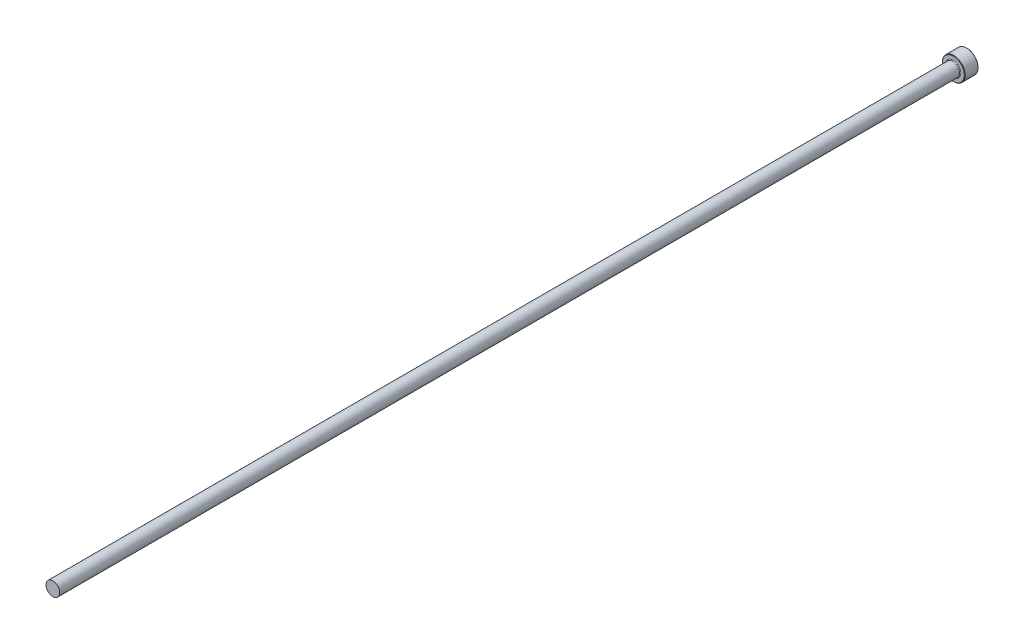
SolidWorks part; units mm, degrees
ref_plane "Front Plane" through (0, 0, 0) normal (0, 0, 1) x (1, 0, 0)
ref_plane "Top Plane" through (0, 0, 0) normal (0, 1, 0) x (1, 0, 0)
ref_plane "Right Plane" through (0, 0, 0) normal (1, 0, 0) x (0, 0, -1)
sketch "Sketch1" plane through (0, 0, 0) normal (1, 0, 0) x (0, 0, -1)
  line L0 (0, 0) -> (0, 5)
  line L1 (0, 5.5) -> (0, -5.5) construction
  line L2 (0, 5) -> (-6, 5)
  line L3 (-6, 5) -> (-6, 3.3)
  line L4 (-6.3, 3) -> (-400, 3)
  line L5 (-400, 3) -> (-400, 0)
  line L6 (5.5, 0) -> (-5.5, 0) construction
  line L7 (-400, 0) -> (0, 0)
  line L8 (-109.0506, 0) -> (16.9928, 0) construction
  arc A0 (-6, 3.3) -> (-6.3, 3) centre (-6.3, 3.3) cw
  dimension "D1" = 0.3
  dimension "D2" = 10
  dimension "D3" = 6
  dimension "D4" = 400
  dimension "D5" = 6
revolve "Revolve1" add sketch "Sketch1" angle 360 about L8
chamfer "Chamfer1" distance 0.2 angle 45 2 edges at (5, 0, 0) (5, 0, 6)
